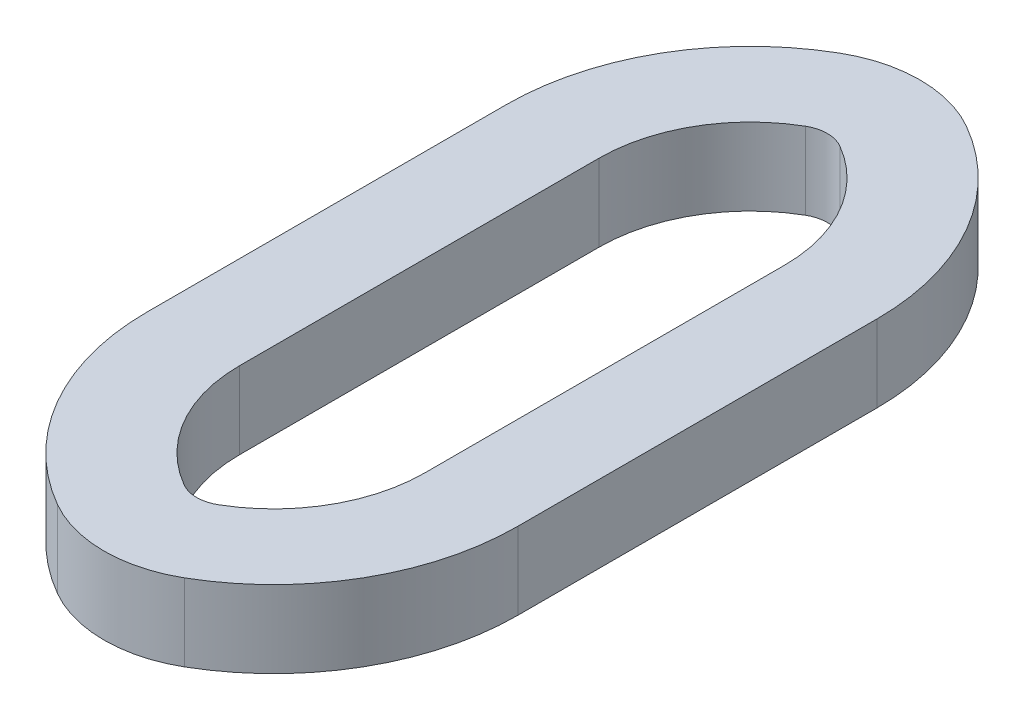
SolidWorks part; units mm, degrees
other "<6021_upper_plate>-<Ø2.5 (2.5) Diameter Hole1>"
ref_plane "X_Y" through (0, 0, 0) normal (0, 0, 1) x (1, 0, 0)
ref_plane "Z_X" through (0, 0, 0) normal (0, 1, 0) x (1, 0, 0)
ref_plane "Y_Z" through (0, 0, 0) normal (1, 0, 0) x (0, 0, -1)
ref_plane "X_Y-6021_upper_plate" through (0, 0, 0) normal (0, 0, 1) x (1, 0, 0)
ref_plane "Z_X-6021_upper_plate" through (0, 0, 0) normal (0, 1, 0) x (1, 0, 0)
ref_plane "Y_Z-6021_upper_plate" through (0, 0, 0) normal (1, 0, 0) x (0, 0, -1)
ref_plane "X_Y-_6021_master-6021_upper_plate" through (0, 0, 0) normal (0, 0, 1) x (1, 0, 0)
ref_plane "Z_X_peltier-_6021_master-6021_upper_plate" through (0, 0, 0) normal (0, 1, 0) x (1, 0, 0)
ref_plane "Y_Z-_6021_master-6021_upper_plate" through (0, 0, 0) normal (1, 0, 0) x (0, 0, -1)
sketch "zx_sketch-_6021_master-6021_upper_plate" plane through (0, 0, 0) normal (0, 1, 0) x (1, 0, 0)
  line L0 (0, 0) -> (0, 39833.2138) construction
  line L1 (-56.5, 24.66) -> (4, 24.66)
  line L2 (-56.5, 24.66) -> (-56.5, -27)
  line L3 (-56.5, -27) -> (56.5, -27)
  line L4 (56.5, 27) -> (56.5, -27)
  line L5 (0, 0) -> (39833.2138, 0) construction
  line L6 (4, 24.66) -> (4, 27)
  line L11 (4, 27) -> (56.5, 27)
  point P3 (0, -27)
  point P17 (-22.5, 15.66)
  point P18 (22.5, 15.66)
  point P19 (22.5, -15.66)
  point P20 (-22.5, -15.66)
  dimension "D1" = 113
  dimension "D2" = 24.66
  dimension "D3" = 45
  dimension "D4" = 31.32
  dimension "D5" = 27
  dimension "D6" = 2.34
  dimension "D7" = 4
  dimension "D8" = 27
sketch "xy_sketch-_6021_master-6021_upper_plate" plane through (0, 0, 0) normal (0, 0, 1) x (1, 0, 0)
  line L0 (0, 0) -> (0, 5) construction
  line L1 (0, 5) -> (0, 10) construction
  dimension "D1" = 5
  dimension "D2" = 5
ref_plane "zx_lower_plate-_6021_master-6021_upper_plate" through (0, 5, 0) normal (0, 1, 0) x (1, 0, 0)
ref_plane "zx_sensor-_6021_master-6021_upper_plate" through (0, 10, 0) normal (0, 1, 0) x (1, 0, 0)
sketch "zx_sensor_sketch-_6021_master-6021_upper_plate" plane through (0, 10, 0) normal (0, 1, 0) x (1, 0, 0)
  line L0 (-42.2, 3.16) -> (-28.2, 8.66) construction
  line L1 (-28.2, 8.66) -> (-14.2, 3.16) construction
  line L2 (-14.2, 3.16) -> (-0.2, 8.66) construction
  line L3 (-42.2, 4.96) -> (-42.2, -0.8) construction
  line L4 (-28.2, 10.46) -> (-28.2, 4.7) construction
  line L5 (-14.2, 4.96) -> (-14.2, -0.8) construction
  line L6 (-0.2, 10.46) -> (-0.2, 4.7) construction
  line L7 (-42.2, 3.16) -> (-42.2, -0.8) construction
  line L8 (-28.2, 8.66) -> (-28.2, 4.7) construction
  line L9 (-14.2, 3.16) -> (-14.2, -0.8) construction
  line L10 (-0.2, 8.66) -> (-0.2, 4.7) construction
  line L11 (-39.215, 3.16) -> (-45.185, 3.16) construction
  line L12 (-39.215, 7.475) -> (-39.215, -1.155) construction
  line L13 (-44.615, 3.16) -> (-39.785, 3.16) construction
  point P8 (-42.2, 2.08)
  point P16 (-42.2, 3.16)
  point P19 (-39.215, 3.16)
  point P22 (-42.2, 3.16)
  dimension "D3" = 14
  dimension "D4" = 1.08
  dimension "D6" = 5.76
  dimension "D7" = 5.97
  dimension "D9" = 8.63
  dimension "D10" = 4.83
  dimension "D11" = 5.5
sketch "zx_valve_sketch-_6021_master-6021_upper_plate" plane through (0, 10.9, 0) normal (0, 1, 0) x (1, 0, 0)
  line L0 (44, -4.25) -> (34, -4.25) construction
  line L1 (34, -4.25) -> (24, -4.25) construction
  line L2 (24, -4.25) -> (14, -4.25) construction
  line L3 (44, -10.5) -> (44, -6.5) construction
  line L4 (44, -6.5) -> (44, -2.5) construction
  line L5 (34, -2.5) -> (34, -6.5) construction
  line L6 (34, -6.5) -> (34, -10.5) construction
  line L7 (24, -2.5) -> (24, -6.5) construction
  line L8 (24, -6.5) -> (24, -10.5) construction
  line L9 (14, -2.5) -> (14, -6.5) construction
  line L10 (14, -6.5) -> (14, -10.5) construction
  line L11 (44, 10.5) -> (44, -19) construction
  line L12 (34, 10.5) -> (34, -19) construction
  line L14 (24, -19) -> (24, 10.5) construction
  line L17 (14, 10.5) -> (14, -19) construction
  point P20 (44, -4.25)
  dimension "D1" = 10
  dimension "D4" = 8
  dimension "D5" = 2.25
  dimension "D6" = 29.5
sketch "zx_manifold_sketch-_6021_master-6021_upper_plate" plane through (0, 5, 0) normal (0, 1, 0) x (1, 0, 0)
  line L0 (-34.0003, 7.58) -> (-22.3997, 7.58) construction
  line L4 (44, 19.5) -> (34, 19.5) construction
  line L5 (34, 19.5) -> (24, 19.5) construction
  line L6 (24, 19.5) -> (14, 19.5) construction
  line L7 (39, 10.5) -> (39, -7.6132)
  line L9 (-48.0003, 2.08) -> (-36.3997, 2.08) construction
  line L11 (-20.0003, 2.08) -> (-8.3997, 2.08) construction
  line L12 (-6.0003, 7.58) -> (5.6003, 7.58) construction
  line L13 (-48.9, -6.72) -> (-2.2958, -6.72)
  line L15 (14, -6.5) -> (24, -6.5)
  line L17 (-14.2, 4.96) -> (-9.7626, 10.5608)
  line L22 (34, -4.7265) -> (44, -4.7265) construction
  line L23 (44, -4.7265) -> (39, -7.6132) construction
  line L24 (-4.2467, 12.0482) -> (-0.2, 10.46)
  line L26 (44, 22) -> (14, 22)
  line L28 (-48.9, -14.72) -> (-30.3969, -14.72)
  line L30 (10.8896, -9.015) -> (7.7791, -11.53) construction
  line L31 (34, -14.5) -> (45, -14.5)
  line L32 (-22.5, -24) -> (44, -24)
  line L35 (-14.2, -0.8) -> (-18.2467, -2.3882)
  line L38 (-52.7667, 2.6469) -> (-51, 17.5)
  line L39 (-28.2, 4.7) -> (-23.7626, -0.9008)
  line L40 (14, 10.5) -> (22.5, 15.66) construction
  line L43 (49, -19) -> (49, -18.5)
  line L45 (-32.2467, 12.0482) -> (-28.2, 10.46)
  line L46 (-37.7626, 10.5608) -> (-42.2, 4.96)
  line L47 (-42.2, -0.8) -> (-46.2467, -2.3882)
  line L48 (-0.2, 4.7) -> (10.8896, -9.015)
  circle A0 centre (34, 19.5) radius 3.85 construction
  circle A1 centre (44, 19.5) radius 3.85 construction
  circle A2 centre (24, 19.5) radius 3.85 construction
  circle A3 centre (14, 19.5) radius 3.85 construction
  arc A4 (34, -10.5) -> (39, -7.6132) centre (34, -4.7265) ccw
  arc A6 (29, 10.5) -> (34, -2.5) centre (48.4, 10.5) ccw
  arc A7 (44, -10.5) -> (39, -7.6132) centre (44, -4.7265) cw
  arc A8 (44, -2.5) -> (49, 10.5) centre (29.6, 10.5) ccw
  arc A11 (45.3208, 21.6226) -> (44, 22) centre (44, 19.5) ccw
  arc A12 (44, -6.5) -> (51.5, 10.5) centre (28.4833, 10.5) ccw
  arc A13 (14, 22) -> (11.6636, 20.3896) centre (14, 19.5) ccw
  arc A15 (34, -14.5) -> (34, -6.5) centre (34, -10.5) cw
  arc A16 (-48.9, -6.72) -> (-48.9, -14.72) centre (-48.9, -10.72) ccw
  arc A17 (44, -24) -> (49, -19) centre (44, -19) ccw
  arc A18 (-22.5, -24) -> (-26.4485, -19.36) centre (-22.5, -20) cw
  arc A19 (-30.3969, -14.72) -> (-26.4485, -19.36) centre (-30.3969, -18.72) cw
  arc A20 (14, -10.5) -> (10.8896, -9.015) centre (14, -6.5) cw
  arc A21 (-4.2467, 12.0482) -> (-9.7626, 10.5608) centre (-6.0003, 7.58) ccw
  circle A22 centre (-51, 17.5) radius 3.85 construction
  arc A23 (-23.7626, -0.9008) -> (-18.2467, -2.3882) centre (-20.0003, 2.08) ccw
  arc A24 (-32.2467, 12.0482) -> (-37.7626, 10.5608) centre (-34.0003, 7.58) ccw
  arc A25 (-46.2467, -2.3882) -> (-52.7667, 2.6469) centre (-48.0003, 2.08) cw
  arc A26 (49, -18.5) -> (45, -14.5) centre (45, -18.5) ccw
  circle A27 centre (-51, 17.5) radius 5.5 construction
  arc A29 (14, 19.5) -> (19, 10.5) centre (8.4, 10.5) cw
  arc A30 (39, 10.5) -> (34, 19.5) centre (28.4, 10.5) ccw
  arc A31 (49, 10.5) -> (44, 19.5) centre (38.4, 10.5) ccw
  arc A32 (29, 10.5) -> (24, 19.5) centre (18.4, 10.5) ccw
  arc A33 (19, 10.5) -> (24, -2.5) centre (38.4, 10.5) ccw
  arc A35 (45.3208, 21.6226) -> (51.5, 10.5) centre (38.4, 10.5) cw
  arc A36 (14, -2.5) -> (11.6636, 20.3896) centre (35.6147, 11.2703) cw
  arc A37 (19.5172, -12.2931) -> (7.7791, -11.53) centre (14, -6.5) cw
  arc A38 (7.7791, -11.53) -> (-2.2958, -6.72) centre (-2.2958, -19.6763) ccw
  arc A39 (24, -10.5) -> (19.5172, -12.2931) centre (24, -17) ccw
  point P121 (-42.2, 2.08)
  dimension "D1" = 30
  dimension "D2" = 7.7
  dimension "D4" = 2.5
  dimension "D5" = 4
  dimension "D6" = 92.9
  dimension "D9" = 4
  dimension "D15" = 4
  dimension "D18" = 4.8
  dimension "D11" = 4
sketch "zx_screws_sketch-_6021_master-6021_upper_plate" plane through (0, 5, 0) normal (0, 1, 0) x (1, 0, 0)
  line L4 (-34.0003, 7.58) -> (-22.3997, 7.58) construction
  line L5 (-20.0003, 2.08) -> (-8.3997, 2.08) construction
  line L6 (-6.0003, 7.58) -> (5.6003, 7.58) construction
  line L7 (-36.3997, 2.08) -> (-48.0003, 2.08) construction
  line L13 (56.5, 27) -> (56.5, -27) construction
  circle A0 centre (52.5, 23) radius 4 construction
  circle A3 centre (52.5, -23) radius 4 construction
  arc A7 (-52.7667, 2.6469) -> (-46.2467, -2.3882) centre (-48.0003, 2.08) ccw construction
  circle A8 centre (-52.5, -23) radius 4 construction
  point P0 (-0.2, -19)
  point P1 (52.5, -23)
  point P2 (52.5, 23)
  point P3 (6.6, 23)
  point P4 (-52.5, -23)
  point P5 (-42.2, 17.5)
ref_plane "yz_sensor-_6021_master-6021_upper_plate" through (-42.2, 0, 0) normal (1, 0, 0) x (0, 0, -1)
ref_plane "zx_valve-_6021_master-6021_upper_plate" through (0, 10.9, 0) normal (0, 1, 0) x (1, 0, 0)
ref_plane "zx_sensor_shelf-_6021_master-6021_upper_plate" through (0, 12.391, 0) normal (0, 1, 0) x (1, 0, 0)
sketch "Sketch7-6021_upper_plate" plane through (0, 5, 0) normal (0, 1, 0) x (1, 0, 0)
  line L6 (-56.5, -27) -> (56.5, -27)
  line L7 (56.5, 27) -> (56.5, -27)
  line L8 (4, 27) -> (56.5, 27)
  line L9 (4, 24.66) -> (4, 27)
  line L10 (-56.5, 24.66) -> (4, 24.66)
  line L11 (-56.5, 24.66) -> (-56.5, -27)
  circle A0 centre (-42.2, 4.96) radius 0.15
  circle A1 centre (-42.2, -0.8) radius 0.15
  circle A2 centre (-28.2, 10.46) radius 0.15
  circle A3 centre (-28.2, 4.7) radius 0.15
  circle A4 centre (-14.2, 4.96) radius 0.15
  circle A5 centre (-14.2, -0.8) radius 0.15
  circle A6 centre (-0.2, 10.46) radius 0.15
  circle A7 centre (-0.2, 4.7) radius 0.15
  circle A8 centre (14, -2.5) radius 0.25
  circle A9 centre (14, -6.5) radius 0.25
  circle A10 centre (14, -10.5) radius 0.15
  circle A11 centre (24, -2.5) radius 0.25
  circle A12 centre (24, -6.5) radius 0.25
  circle A13 centre (24, -10.5) radius 0.6
  circle A14 centre (34, -2.5) radius 0.25
  circle A15 centre (34, -6.5) radius 0.6
  circle A16 centre (34, -10.5) radius 0.25
  circle A17 centre (44, -2.5) radius 0.25
  circle A18 centre (44, -6.5) radius 0.25
  circle A19 centre (44, -10.5) radius 0.25
  circle A20 centre (-51, 17.5) radius 0.25
  circle A21 centre (14, 19.5) radius 0.25
  circle A22 centre (24, 19.5) radius 0.25
  circle A23 centre (34, 19.5) radius 0.25
  circle A24 centre (44, 19.5) radius 0.25
  dimension "D1" = 0.3
  dimension "D2" = 0.5
  dimension "D3" = 1.2
sketch "Sketch8-6021_upper_plate" plane through (0, 10, 0) normal (0, 1, 0) x (1, 0, 0)
  line L2 (14, 24) -> (44, 24)
  line L3 (14, 15) -> (44, 15)
  circle A0 centre (-51, 17.5) radius 4.5
  arc A1 (14, 24) -> (14, 15) centre (14, 19.5) ccw
  arc A2 (44, 24) -> (44, 15) centre (44, 19.5) cw
  circle A8 centre (44, 19.5) radius 0.25
  circle A9 centre (34, 19.5) radius 0.25
  circle A10 centre (24, 19.5) radius 0.25
  circle A11 centre (14, 19.5) radius 0.25
  circle A12 centre (-51, 17.5) radius 0.25
  dimension "D1" = 9
sketch "Sketch17-6021_upper_plate" plane through (0, 10, 0) normal (0, 1, 0) x (1, 0, 0)
  line L1 (8.5, 15) -> (49.5, 15)
  line L2 (8.5, 15) -> (8.5, -23.5)
  line L3 (8.5, -23.5) -> (49.5, -23.5)
  line L4 (49.5, 15) -> (49.5, -23.5)
  circle A4 centre (44, -2.5) radius 0.25
  circle A5 centre (34, -2.5) radius 0.25
  circle A6 centre (24, -2.5) radius 0.25
  circle A7 centre (14, -2.5) radius 0.25
  circle A12 centre (44, -6.5) radius 0.25
  circle A13 centre (34, -6.5) radius 0.6
  circle A14 centre (24, -6.5) radius 0.25
  circle A15 centre (14, -6.5) radius 0.25
  circle A20 centre (44, -10.5) radius 0.25
  circle A21 centre (34, -10.5) radius 0.25
  circle A22 centre (24, -10.5) radius 0.6
  circle A23 centre (14, -10.5) radius 0.15
  circle A32 centre (44, 19.5) radius 0.25
  circle A33 centre (34, 19.5) radius 0.25
  circle A34 centre (24, 19.5) radius 0.25
  circle A35 centre (14, 19.5) radius 0.25
  point P51 (29, -23.5)
  point P64 (49.5, -4.25)
  dimension "D1" = 38.5
  dimension "D2" = 41
sketch "Sketch15-6021_upper_plate" plane through (0, 10, 0) normal (0, 1, 0) x (1, 0, 0)
  line L2 (-46.025, 2.08) -> (-45.0281, 2.08) construction
  line L7 (-41.25, 3.9208) -> (-41.25, 0.2392)
  line L8 (-43.15, 3.9208) -> (-43.15, 0.2392)
  line L9 (-42.8, 3.9208) -> (-42.2, 4.96) construction
  line L10 (-42.2, 4.96) -> (-42.35, 4.96) construction
  arc A0 (-42.375, 5.2631) -> (-42.025, 5.2631) centre (-42.2, 4.96) cw
  arc A2 (-42.375, 5.2631) -> (-43.15, 3.9208) centre (-41.6, 3.9208) ccw
  arc A3 (-42.025, 5.2631) -> (-41.25, 3.9208) centre (-42.8, 3.9208) cw
  arc A4 (-42.025, -1.1031) -> (-41.25, 0.2392) centre (-42.8, 0.2392) ccw
  arc A5 (-42.375, -1.1031) -> (-43.15, 0.2392) centre (-41.6, 0.2392) cw
  arc A6 (-42.375, -1.1031) -> (-42.025, -1.1031) centre (-42.2, -0.8) ccw
  point P12 (-42.2, 2.08)
  dimension "D1" = 1.9
  dimension "D2" = 60
sketch "Sketch16-6021_upper_plate" plane through (0, 10, 0) normal (0, 1, 0) x (1, 0, 0)
  line L8 (-41.25, 0.2392) -> (-41.25, 3.9208)
  line L9 (-43.15, 3.9208) -> (-43.15, 0.2392)
  line L66 (-39.75, 0.2392) -> (-39.75, 3.9208)
  line L67 (-44.65, 3.9208) -> (-44.65, 0.2392)
  arc A11 (-42.375, -1.1031) -> (-42.025, -1.1031) centre (-42.2, -0.8) ccw
  arc A24 (-41.25, 3.9208) -> (-42.025, 5.2631) centre (-42.8, 3.9208) ccw
  arc A25 (-42.025, -1.1031) -> (-41.25, 0.2392) centre (-42.8, 0.2392) ccw
  arc A27 (-43.15, 0.2392) -> (-42.375, -1.1031) centre (-41.6, 0.2392) ccw
  arc A28 (-42.375, 5.2631) -> (-43.15, 3.9208) centre (-41.6, 3.9208) ccw
  arc A35 (-43.125, -2.4021) -> (-41.275, -2.4021) centre (-42.2, -0.8) ccw
  arc A36 (-39.75, 3.9208) -> (-41.275, 6.5621) centre (-42.8, 3.9208) ccw
  arc A37 (-41.275, -2.4021) -> (-39.75, 0.2392) centre (-42.8, 0.2392) ccw
  arc A39 (-44.65, 0.2392) -> (-43.125, -2.4021) centre (-41.6, 0.2392) ccw
  arc A40 (-43.125, 6.5621) -> (-44.65, 3.9208) centre (-41.6, 3.9208) ccw
  arc A45 (-41.275, 6.5621) -> (-43.125, 6.5621) centre (-42.2, 4.96) ccw
  arc A47 (-42.025, 5.2631) -> (-42.375, 5.2631) centre (-42.2, 4.96) ccw
sketch "text-6021_upper_plate" plane through (0, 10, 0) normal (0, 1, 0) x (1, 0, 0)
  line L1 (14, -976.24) -> (14, 49023.76) construction
  line L2 (24, -976.24) -> (24, 49023.76) construction
  line L3 (34, -976.24) -> (34, 49023.76) construction
  line L4 (44, -976.24) -> (44, 49023.76) construction
  line L5 (-51, -983.5) -> (-51, 49016.5) construction
  text T0 "O" font "Verdana" height 1.8
  text T1 "R" font "Verdana" height 1.8
  text T2 "W" font "Verdana" height 1.8
  text T3 "B" font "Verdana" height 1.8
  text T4 "I" font "Segoe UI" height 1.8
sketch "xz_cover-_6021_master-6021_upper_plate" plane through (0, 0, 0) normal (0, 1, 0) x (1, 0, 0)
  line L1 (-63, -36.79) -> (63, -36.79)
  line L2 (-71.85, -27.94) -> (-71.85, 30.02)
  line L3 (-71.85, 30.02) -> (71.85, 30.02)
  line L4 (71.85, -27.94) -> (71.85, 30.02)
  line L5 (-71.85, -36.79) -> (71.85, 30.02) construction
  line L6 (-71.85, 30.02) -> (71.85, -36.79) construction
  line L7 (0, -1003.385) -> (0, 48996.615) construction
  arc A0 (71.85, -27.94) -> (63, -36.79) centre (63, -27.94) cw
  arc A1 (-63, -36.79) -> (-71.85, -27.94) centre (-63, -27.94) cw
  circle A2 centre (-64.495, 5.21) radius 3.6
  circle A3 centre (64.495, 5.21) radius 3.6
  point P0 (0, -3.385)
  dimension "D4" = 8.85
  dimension "D5" = 42
  dimension "D7" = 7.2
  dimension "D1" = 66.81
  dimension "D2" = 143.7
  dimension "D6" = 128.99
sketch "Sketch20-6021_upper_plate" plane through (0, 5, 0) normal (0, -1, 0) x (1, 0, 0)
  line L3 (10.7729, 9.1093) -> (-0.3166, -4.6057)
  line L6 (-42.3176, -5.0531) -> (-37.8802, -10.6539)
  line L7 (-32.1919, -12.1878) -> (-28.1452, -10.5996)
  line L10 (-42.0824, -4.8669) -> (-37.645, -10.4676)
  line L11 (-32.3015, -11.9086) -> (-28.2548, -10.3204)
  line L13 (11.0062, 8.9207) -> (-0.0834, -4.7943)
  line L16 (-18.3015, 2.2486) -> (-14.2548, 0.6604)
  line L17 (-28.0824, -4.7931) -> (-23.645, 0.8076)
  line L20 (-18.1919, 2.5278) -> (-14.1452, 0.9396)
  line L21 (-28.3176, -4.6069) -> (-23.8802, 0.9939)
  line L23 (-42.3176, -5.0531) -> (-42.0824, -4.8669)
  line L26 (-4.1919, -12.1878) -> (-0.1452, -10.5996)
  line L27 (-14.3176, -5.0531) -> (-9.8802, -10.6539)
  line L30 (-4.3015, -11.9086) -> (-0.2548, -10.3204)
  line L31 (-14.0824, -4.8669) -> (-9.645, -10.4676)
  line L36 (-28.1452, -10.5996) -> (-28.2548, -10.3204)
  line L37 (-28.0824, -4.7931) -> (-28.3176, -4.6069)
  line L38 (-14.2548, 0.6604) -> (-14.1452, 0.9396)
  line L39 (-14.3176, -5.0531) -> (-14.0824, -4.8669)
  line L40 (-0.1452, -10.5996) -> (-0.2548, -10.3204)
  line L41 (-0.0834, -4.7943) -> (-0.3166, -4.6057)
  line L42 (14, 10.35) -> (14, 10.65)
  arc A3 (-37.8802, -10.6539) -> (-32.1919, -12.1878) centre (-34.0003, -7.58) ccw
  arc A5 (-37.645, -10.4676) -> (-32.3015, -11.9086) centre (-34.0003, -7.58) ccw
  arc A8 (-18.3015, 2.2486) -> (-23.645, 0.8076) centre (-20.0003, -2.08) ccw
  arc A10 (-18.1919, 2.5278) -> (-23.8802, 0.9939) centre (-20.0003, -2.08) ccw
  arc A13 (-9.8802, -10.6539) -> (-4.1919, -12.1878) centre (-6.0003, -7.58) ccw
  arc A15 (-9.645, -10.4676) -> (-4.3015, -11.9086) centre (-6.0003, -7.58) ccw
  arc A16 (14, 10.65) -> (10.7729, 9.1093) centre (14, 6.5) ccw
  arc A19 (14, 10.35) -> (11.0062, 8.9207) centre (14, 6.5) ccw
sketch "Sketch21-6021_upper_plate" plane through (0, 5, 0) normal (0, -1, 0) x (1, 0, 0)
  line L2 (14, 6.25) -> (24, 6.25)
  line L3 (14, 6.25) -> (14, 6.75)
  line L6 (-53.015, -2.6765) -> (-51.2483, -17.5295)
  line L7 (-42.2018, 1.0693) -> (-46.1553, 2.6209)
  line L10 (-52.5185, -2.6174) -> (-50.7517, -17.4705)
  line L11 (-42.3844, 0.6038) -> (-46.338, 2.1555)
  line L12 (14, 6.75) -> (24, 6.75)
  line L13 (24, 6.25) -> (24, 6.75)
  line L22 (-51.2483, -17.5295) -> (-50.7517, -17.4705)
  line L24 (39.25, -10.5) -> (39.25, 7.5455)
  line L26 (38.75, -10.5) -> (38.75, 7.5455)
  line L28 (13.7892, 2.6343) -> (14.2108, 2.3657)
  line L29 (14.1321, -19.7123) -> (13.8679, -19.2877)
  line L30 (23.8144, 2.6675) -> (24.1856, 2.3325)
  line L31 (34.1856, 2.3325) -> (33.8144, 2.6675)
  line L32 (24.1321, -19.7123) -> (23.8679, -19.2877)
  line L33 (34.1321, -19.7123) -> (33.8679, -19.2877)
  line L34 (44.1321, -19.7123) -> (43.8679, -19.2877)
  line L35 (34, 10.25) -> (34, 10.75)
  line L36 (44, 10.25) -> (44, 10.75)
  line L38 (43.8144, 2.3325) -> (44.1856, 2.6675)
  line L41 (44.1685, 6.6846) -> (43.8315, 6.3154)
  line L44 (14, -22.25) -> (44, -22.25)
  line L46 (14, -21.75) -> (44, -21.75)
  arc A3 (-46.1553, 2.6209) -> (-53.015, -2.6765) centre (-48.0003, -2.08) ccw
  arc A5 (-46.338, 2.1555) -> (-52.5185, -2.6174) centre (-48.0003, -2.08) ccw
  arc A41 (24.1856, 2.3325) -> (19.25, -10.5) centre (38.4, -10.5) ccw
  arc A42 (14.1321, -19.7123) -> (19.25, -10.5) centre (8.4, -10.5) ccw
  arc A45 (23.8144, 2.6675) -> (18.75, -10.5) centre (38.4, -10.5) ccw
  arc A46 (13.8679, -19.2877) -> (18.75, -10.5) centre (8.4, -10.5) ccw
  arc A48 (39, 8.0855) -> (34, 10.75) centre (34, 4.7265) ccw
  arc A51 (23.8679, -19.2877) -> (28.75, -10.5) centre (18.4, -10.5) ccw
  arc A52 (33.8144, 2.6675) -> (28.75, -10.5) centre (48.4, -10.5) ccw
  arc A55 (24.1321, -19.7123) -> (29.25, -10.5) centre (18.4, -10.5) ccw
  arc A56 (34.1856, 2.3325) -> (29.25, -10.5) centre (48.4, -10.5) ccw
  arc A57 (38.75, 7.5455) -> (34, 10.25) centre (34, 4.7265) ccw
  arc A64 (44, 10.25) -> (39.25, 7.5455) centre (44, 4.7265) ccw
  arc A65 (34.1321, -19.7123) -> (39.25, -10.5) centre (28.4, -10.5) ccw
  arc A68 (44, 10.75) -> (39, 8.0855) centre (44, 4.7265) ccw
  arc A69 (33.8679, -19.2877) -> (38.75, -10.5) centre (28.4, -10.5) ccw
  arc A75 (-42.3844, 0.6038) -> (-42.2018, 1.0693) centre (-42.2931, 0.8365) ccw
  arc A79 (44.1321, -19.7123) -> (49.25, -10.5) centre (38.4, -10.5) ccw
  arc A80 (49.25, -10.5) -> (44.1856, 2.6675) centre (29.6, -10.5) ccw
  arc A83 (43.8679, -19.2877) -> (48.75, -10.5) centre (38.4, -10.5) ccw
  arc A84 (48.75, -10.5) -> (43.8144, 2.3325) centre (29.6, -10.5) ccw
  arc A87 (51.75, -10.5) -> (44.1685, 6.6846) centre (28.4833, -10.5) ccw
  arc A88 (45.4528, -21.8349) -> (51.75, -10.5) centre (38.4, -10.5) ccw
  arc A89 (44, -22.25) -> (45.4528, -21.8349) centre (44, -19.5) ccw
  arc A90 (11.43, -20.4785) -> (14, -22.25) centre (14, -19.5) ccw
  arc A91 (13.7892, 2.6343) -> (11.43, -20.4785) centre (35.6147, -11.2703) ccw
  arc A97 (51.25, -10.5) -> (43.8315, 6.3154) centre (28.4833, -10.5) ccw
  arc A98 (45.1887, -21.4104) -> (51.25, -10.5) centre (38.4, -10.5) ccw
  arc A99 (44, -21.75) -> (45.1887, -21.4104) centre (44, -19.5) ccw
  arc A100 (11.8973, -20.3006) -> (14, -21.75) centre (14, -19.5) ccw
  arc A101 (14.2108, 2.3657) -> (11.8973, -20.3006) centre (35.6147, -11.2703) ccw
sketch "Sketch22-6021_upper_plate" plane through (0, 5, 0) normal (0, -1, 0) x (1, 0, 0)
  line L44 (45, 15.1) -> (34, 15.1)
  line L45 (48.4, 19) -> (48.4, 18.5)
  line L46 (-22.5, 23.4) -> (44, 23.4)
  line L47 (-48.9, 14.12) -> (-30.3969, 14.12)
  line L48 (-2.2958, 7.32) -> (-48.9, 7.32)
  line L56 (24, 9.9) -> (24, 11.1)
  line L57 (34, 5.9) -> (34, 7.1)
  line L68 (45, 13.9) -> (34, 13.9)
  line L69 (49.6, 19) -> (49.6, 18.5)
  line L70 (-22.5, 24.6) -> (44, 24.6)
  line L71 (-48.9, 15.32) -> (-30.3969, 15.32)
  line L72 (-2.2958, 6.12) -> (-48.9, 6.12)
  arc A0 (19.931, 12.7276) -> (24, 11.1) centre (24, 17) ccw
  arc A1 (19.1034, 11.8586) -> (24, 9.9) centre (24, 17) ccw
  arc A78 (34, 15.1) -> (34, 5.9) centre (34, 10.5) ccw
  arc A79 (45, 15.1) -> (48.4, 18.5) centre (45, 18.5) ccw
  arc A80 (48.4, 19) -> (44, 23.4) centre (44, 19) ccw
  arc A81 (-22.5, 23.4) -> (-25.8562, 19.456) centre (-22.5, 20) ccw
  arc A82 (-30.3969, 14.12) -> (-25.8562, 19.456) centre (-30.3969, 18.72) ccw
  arc A83 (-48.9, 14.12) -> (-48.9, 7.32) centre (-48.9, 10.72) ccw
  arc A84 (-2.2958, 7.32) -> (7.3126, 11.9073) centre (-2.2958, 19.6763) ccw
  arc A85 (19.931, 12.7276) -> (7.3126, 11.9073) centre (14, 6.5) ccw
  arc A96 (34, 13.9) -> (34, 7.1) centre (34, 10.5) ccw
  arc A97 (45, 13.9) -> (49.6, 18.5) centre (45, 18.5) ccw
  arc A98 (49.6, 19) -> (44, 24.6) centre (44, 19) ccw
  arc A99 (-22.5, 24.6) -> (-27.0407, 19.264) centre (-22.5, 20) ccw
  arc A100 (-30.3969, 15.32) -> (-27.0407, 19.264) centre (-30.3969, 18.72) ccw
  arc A101 (-48.9, 15.32) -> (-48.9, 6.12) centre (-48.9, 10.72) ccw
  arc A102 (-2.2958, 6.12) -> (8.2457, 11.1528) centre (-2.2958, 19.6763) ccw
  arc A103 (19.1034, 11.8586) -> (8.2457, 11.1528) centre (14, 6.5) ccw
sketch "Sketch29-6021_upper_plate" plane through (0, 10, 0) normal (0, 1, 0) x (1, 0, 0)
  line L4 (8.5, 15) -> (8.5, -23.5)
  line L5 (8.5, -23.5) -> (49.5, -23.5)
  line L6 (49.5, 15) -> (49.5, -23.5)
  line L7 (8.5, 15) -> (49.5, 15)
  point P7 (29, -23.5)
  point P8 (49.5, -4.25)
  dimension "D1" = 38.5
  dimension "D2" = 41
inserted part "6021_upper_plate"
sketch "Sketch13" plane through (0, 9.4, 0) normal (0, 1, 0) x (1, 0, 0)
  line L4 (-44.1, 3.9208) -> (-44.1, 0.2392)
  line L5 (-40.3, 0.2392) -> (-40.3, 3.9208)
  line L6 (-44.1, 3.9208) -> (-44.1, 0.2392)
  line L7 (-40.3, 0.2392) -> (-40.3, 3.9208)
  line L9 (-41.25, 0.2392) -> (-41.25, 3.9208)
  line L10 (-41.25, 0.2392) -> (-41.25, 3.9208)
  line L11 (-43.15, 3.9208) -> (-43.15, 0.2392)
  line L12 (-43.15, 3.9208) -> (-43.15, 0.2392)
  arc A6 (-41.55, 6.0858) -> (-42.85, 6.0858) centre (-42.2, 4.96) ccw
  arc A7 (-41.55, 6.0858) -> (-42.85, 6.0858) centre (-42.2, 4.96) ccw
  arc A8 (-42.85, -1.9258) -> (-41.55, -1.9258) centre (-42.2, -0.8) ccw
  arc A9 (-42.85, -1.9258) -> (-41.55, -1.9258) centre (-42.2, -0.8) ccw
  arc A10 (-42.025, 5.2631) -> (-42.375, 5.2631) centre (-42.2, 4.96) ccw
  arc A11 (-42.025, 5.2631) -> (-42.375, 5.2631) centre (-42.2, 4.96) ccw
  arc A12 (-40.3, 3.9208) -> (-41.55, 6.0858) centre (-42.8, 3.9208) ccw
  arc A13 (-41.25, 3.9208) -> (-42.025, 5.2631) centre (-42.8, 3.9208) ccw
  arc A14 (-42.85, 6.0858) -> (-44.1, 3.9208) centre (-41.6, 3.9208) ccw
  arc A15 (-44.1, 0.2392) -> (-42.85, -1.9258) centre (-41.6, 0.2392) ccw
  arc A16 (-41.25, 3.9208) -> (-42.025, 5.2631) centre (-42.8, 3.9208) ccw
  arc A17 (-41.55, -1.9258) -> (-40.3, 0.2392) centre (-42.8, 0.2392) ccw
  arc A18 (-40.3, 3.9208) -> (-41.55, 6.0858) centre (-42.8, 3.9208) ccw
  arc A20 (-42.85, 6.0858) -> (-44.1, 3.9208) centre (-41.6, 3.9208) ccw
  arc A21 (-44.1, 0.2392) -> (-42.85, -1.9258) centre (-41.6, 0.2392) ccw
  arc A23 (-41.55, -1.9258) -> (-40.3, 0.2392) centre (-42.8, 0.2392) ccw
  arc A24 (-42.025, -1.1031) -> (-41.25, 0.2392) centre (-42.8, 0.2392) ccw
  arc A25 (-42.025, -1.1031) -> (-41.25, 0.2392) centre (-42.8, 0.2392) ccw
  arc A26 (-42.375, -1.1031) -> (-42.025, -1.1031) centre (-42.2, -0.8) ccw
  arc A27 (-42.375, -1.1031) -> (-42.025, -1.1031) centre (-42.2, -0.8) ccw
  arc A28 (-43.15, 0.2392) -> (-42.375, -1.1031) centre (-41.6, 0.2392) ccw
  arc A29 (-43.15, 0.2392) -> (-42.375, -1.1031) centre (-41.6, 0.2392) ccw
  arc A30 (-42.375, 5.2631) -> (-43.15, 3.9208) centre (-41.6, 3.9208) ccw
  arc A31 (-42.375, 5.2631) -> (-43.15, 3.9208) centre (-41.6, 3.9208) ccw
  dimension "D1" = 0.55
  dimension "D3" = 0
extrude "Boss-Extrude1" add sketch "Sketch13" along normal blind 0.79 separate body
delete or keep bodies "Body-Delete/Keep 1" type delete bodies bodies 101
